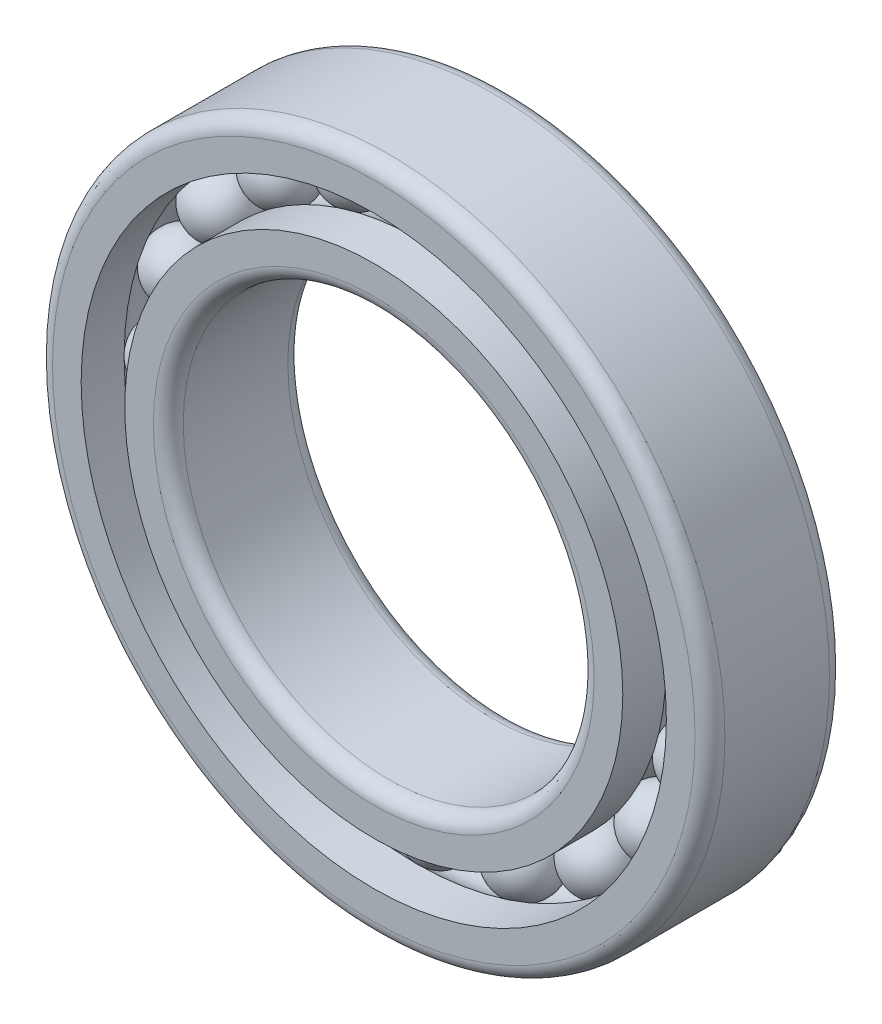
SolidWorks part; units mm, degrees
ref_plane "Front Plane" through (0, 0, 0) normal (0, 0, 1) x (1, 0, 0)
ref_plane "Top Plane" through (0, 0, 0) normal (0, 1, 0) x (1, 0, 0)
ref_plane "Right Plane" through (0, 0, 0) normal (1, 0, 0) x (0, 0, -1)
other "Configuration Table"
sketch "BaseSke" plane through (0, 0, 0) normal (1, 0, 0) x (0, 0, -1)
  line L0 (-47.2296, 0) -> (24.6132, 0) construction
  line L1 (-47.2296, 36.25) -> (24.6132, 36.25) construction
  line L2 (0, 129.5214) -> (0, -86.3012) construction
  line L3 (0, 40.625) -> (0, 31.875)
  line L4 (-9, 45) -> (9, 45) construction
  line L5 (-9, 27.5) -> (9, 27.5) construction
  arc A0 (0, 40.625) -> (0, 31.875) centre (0, 36.25) ccw
revolve "Ball" add sketch "BaseSke" angle 360 about L3
sketch "OuterRaceSke" plane through (0, 0, 0) normal (1, 0, 0) x (0, 0, -1)
  line L0 (0, 0) -> (0, 87.5396) construction
  line L1 (-9, 45) -> (9, 45)
  line L2 (-9, 45) -> (-9, 39.1667)
  line L3 (-9, 39.1667) -> (-3.2475, 39.1667)
  line L4 (9, 45) -> (9, 39.1667)
  line L5 (-50.3916, 0) -> (55.2197, 0) construction
  line L6 (-47.2296, 36.25) -> (24.6132, 36.25) construction
  line L7 (3.2475, 39.1667) -> (9, 39.1667)
  arc A0 (3.2475, 39.1667) -> (-3.2475, 39.1667) centre (0, 36.25) ccw
revolve "OuterRace" add sketch "OuterRaceSke" angle 360 about L5
sketch "InnerRaceSke" plane through (0, 0, 0) normal (1, 0, 0) x (0, 0, -1)
  line L0 (-70.8626, 0) -> (113.5527, 0) construction
  line L1 (0, 58.441) -> (0, -70.8113) construction
  line L2 (-9, 27.5) -> (9, 27.5)
  line L3 (-9, 27.5) -> (-9, 33.3333)
  line L4 (-9, 33.3333) -> (-3.2475, 33.3333)
  line L5 (9, 27.5) -> (9, 33.3333)
  line L6 (0, 129.5214) -> (0, -86.3012) construction
  line L7 (3.2475, 33.3333) -> (9, 33.3333)
  arc A0 (-3.2475, 33.3333) -> (3.2475, 33.3333) centre (0, 36.25) ccw
  arc A1 (0, 40.625) -> (0, 31.875) centre (0, 36.25) ccw construction
revolve "InnerRace" add sketch "InnerRaceSke" angle 360 about L0
fillet "Fillet1" radius 2 4 edges at (27.5, 0, -9) (27.5, 0, 9) (45, 0, -9) (45, 0, 9)
sketch "ShieldedSke" plane through (0, 0, 0) normal (1, 0, 0) x (0, 0, -1)
  line L1 (-8, 39.1667) -> (-6, 39.1667)
  line L2 (-9, 38.1667) -> (-9, 34.3333)
  line L3 (-8, 33.3333) -> (-6, 33.3333)
  line L4 (-6, 39.1667) -> (-6, 33.3333)
  arc A0 (-8, 39.1667) -> (-9, 38.1667) centre (-8, 38.1667) ccw
  arc A1 (-9, 34.3333) -> (-8, 33.3333) centre (-8, 34.3333) ccw
  point P12 (-9, 39.1667)
  point P13 (-9, 33.3333)
revolve "Shielded" [suppressed] add sketch "ShieldedSke" angle 360 about L0
mirror "DoubleShielded" [suppressed] about plane through (0, 0, 0) normal (0, 0, 1)
sketch "SealedSke" plane through (0, 0, 0) normal (1, 0, 0) x (0, 0, -1)
  line L0 (-34.5153, 0) -> (39.09, 0) construction
  line L1 (-27.2, 33.3333) -> (-7.2, 33.3333)
  line L2 (-27.2, 33.3333) -> (-27.2, 39.1667)
  line L3 (-27.2, 39.1667) -> (-7.2, 39.1667)
  line L4 (-7.2, 33.3333) -> (-7.2, 39.1667)
revolve "Sealed" [suppressed] cut sketch "SealedSke" angle 360 about L0
mirror "DoubleSealed" [suppressed] about plane through (0, 0, 0) normal (0, 0, 1)
pattern_circular "CirPatternBall" count 20 over 360 about axis through (0, 0, 0) along (0, 0, 1) of "Ball"
sketch "CutGrooveSke" plane through (0, 0, 0) normal (1, 0, 0) x (0, 0, -1)
  line L0 (-51.8407, 0) -> (83.8302, 0) construction
  line L1 (5.4, -64.1) -> (4.5, -64.1)
  line L2 (5.4, -64.1) -> (5.4, -44.1)
  line L3 (5.4, -44.1) -> (4.5, -44.1)
  line L4 (4.5, -64.1) -> (4.5, -44.1)
revolve "CutGroove" [suppressed] cut sketch "CutGrooveSke" angle 360 about L0
sketch "TaperSke" plane through (0, 0, 0) normal (1, 0, 0) x (0, 0, -1)
  line L0 (-9, 27.5) -> (9, 27.5)
  line L1 (9, 27.5) -> (9, 29)
  line L2 (9, 29) -> (-9, 27.5)
  line L7 (-41.2502, 0) -> (40.8606, 0) construction
revolve "Taper" [suppressed] cut sketch "TaperSke" angle 360 about L7
fillet "Fillet2" [suppressed] radius 2
sketch "SimplifiedSke" plane through (0, 0, 0) normal (1, 0, 0) x (0, 0, -1)
  line L0 (37.5911, 0) -> (-37.5911, 0) construction
  circle A0 centre (0, 36.25) radius 4.375
  arc A1 (0, 40.625) -> (0, 31.875) centre (0, 36.25) ccw construction
revolve "Simplified" [suppressed] add sketch "SimplifiedSke" angle 360 about L0
equation "\"D1@BaseSke\" =  (\"Bearing_Outside_Diameter@BaseSke\"  +  \"Bearing_Inside_Diameter@BaseSke\"  )  / 4"
equation "\"Ball_diameter@BaseSke\" =  ( \"Bearing_Outside_Diameter@BaseSke\" - \"Bearing_Inside_Diameter@BaseSke\" ) / 4 "
equation "\"D2@OuterRaceSke\" = \"Bearing_Outside_Diameter@BaseSke\" -  ( \"Bearing_Outside_Diameter@BaseSke\" - \"Bearing_Inside_Diameter@BaseSke\" )  / 3"
equation "\"D4@OuterRaceSke\" = (  \"Bearing_Outside_Diameter@BaseSke\" - \"Bearing_Inside_Diameter@BaseSke\" ) / 4 -0.02"
equation "\"D1@InnerRaceSke\" = \"Bearing_Inside_Diameter@BaseSke\" +  ( \"Bearing_Outside_Diameter@BaseSke\" - \"Bearing_Inside_Diameter@BaseSke\" )  / 3"
equation "\"D2@InnerRaceSke\" = \"D4@OuterRaceSke\""
equation "\"D1@ShieldedSke\" = \"Fillet_radius@Fillet1\"/2"
equation "\"D2@ShieldedSke\" = \"Bearing_Thickness@BaseSke\"/3"
equation "\"D2@SealedSke\" = \"Bearing_Thickness@BaseSke\"/2.5"
equation "\"D1@CirPatternBall\" = int( \"D1@BaseSke\"* pi  * 2 / \"Ball_diameter@BaseSke\"/1.2 ) -1"
equation "\"D1@CutGrooveSke\" = \"Bearing_Outside_Diameter@BaseSke\" * 0.49"
equation "\"D2@CutGrooveSke\" = \"Bearing_Thickness@BaseSke\" *0.25"
equation "\"D3@CutGrooveSke\" = \"Bearing_Thickness@BaseSke\"/20"
equation "\"Taper@TaperSke\" = \"Bearing_Thickness@BaseSke\"/12"
equation "\"D1@Fillet2\" = \"Fillet_radius@Fillet1\""
